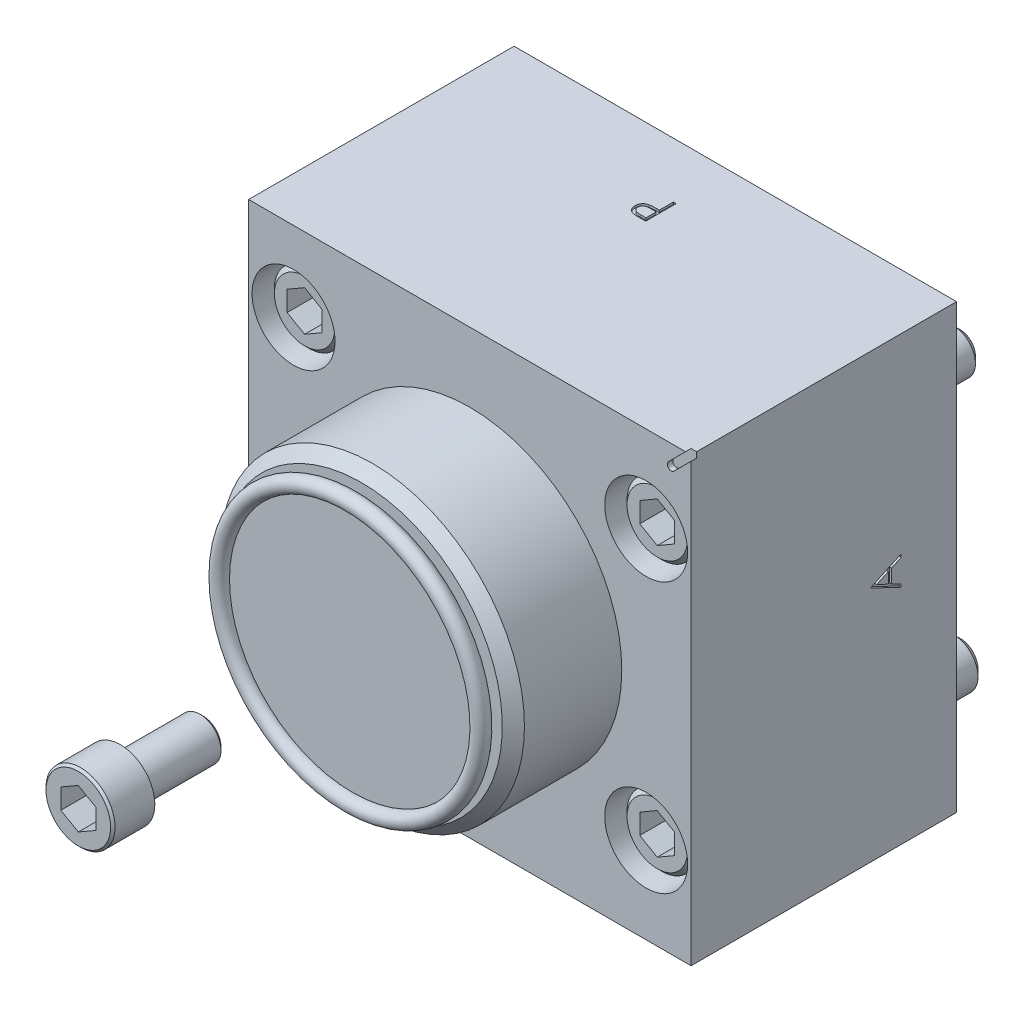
SolidWorks part; units mm, degrees
ref_plane "Front Plane" through (0, 0, 0) normal (0, 0, 1) x (1, 0, 0)
ref_plane "Top Plane" through (0, 0, 0) normal (0, 1, 0) x (1, 0, 0)
ref_plane "Right Plane" through (0, 0, 0) normal (1, 0, 0) x (0, 0, -1)
imported_body "Imported1"
imported_body "Imported2"
sketch "Sketch1" plane through (0, 0, 0) normal (1, 0, 0) x (0, 0, -1)
  line L0 (0, 0) -> (-30.48, 0) construction
  line L1 (0, 0) -> (0, 50.8) construction
  text T0 "<r90>A</r>"
  point P3 (0, 25.4)
  dimension "D1" = 25.4
  dimension "D2" = 6.35
extrude "Cut-Extrude1" cut sketch "Sketch1" against normal blind 0.254
sketch "Sketch2" plane through (0, 50.8, 0) normal (0, 1, 0) x (1, 0, 0)
  line L0 (0, -29.845) -> (0, 0) construction
  line L1 (0, 0) -> (-50.8, 0) construction
  text T0 "<r180>P</r>"
  dimension "D1" = 25.4
  dimension "D2" = 6.35
extrude "Cut-Extrude2" cut sketch "Sketch2" against normal blind 0.254
sketch "Sketch3" plane through (-50.8, 0, 0) normal (-1, 0, 0) x (0, 0, 1)
  line L0 (30.48, 50.8) -> (0, 50.8) construction
  line L1 (0, 50.8) -> (0, 0) construction
  text T0 "<r-90>B</r>"
  dimension "D1" = 25.4
  dimension "D2" = 6.35
extrude "Cut-Extrude3" cut sketch "Sketch3" against normal blind 0.254
sketch "Sketch4" plane through (0, 0, 0) normal (0, -1, 0) x (1, 0, 0)
  line L0 (-50.8, 30.48) -> (-50.8, 0) construction
  line L1 (-50.8, 0) -> (0, 0) construction
  text T0 "T"
  dimension "D1" = 25.4
  dimension "D2" = 6.35
extrude "Cut-Extrude5" cut sketch "Sketch4" against normal blind 0.254
